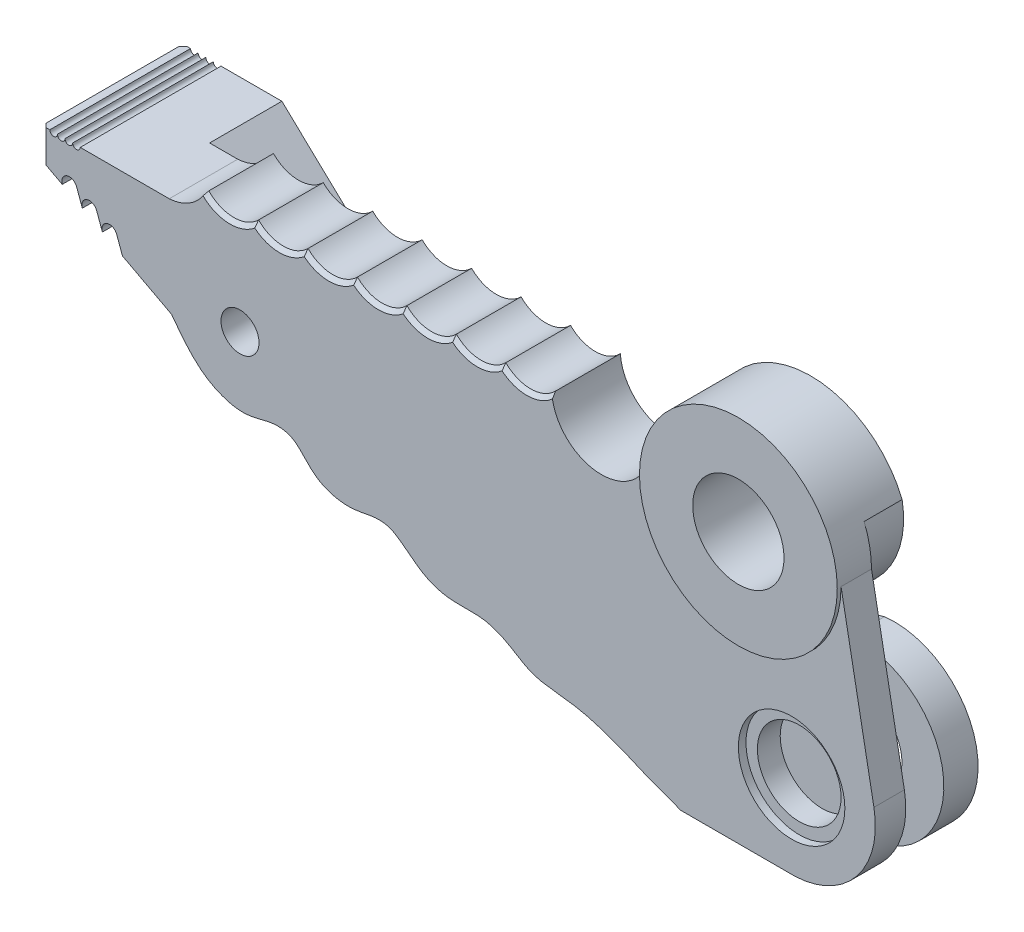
SolidWorks part; units mm, degrees
ref_plane "Plan de face" through (0, 0, 0) normal (0, 0, 1) x (1, 0, 0)
ref_plane "Plan de dessus" through (0, 0, 0) normal (0, 1, 0) x (1, 0, 0)
ref_plane "Plan de droite" through (0, 0, 0) normal (1, 0, 0) x (0, 0, -1)
sketch "Esquisse1" plane through (0, 0, 0) normal (0, 0, 1) x (1, 0, 0)
  line L0 (-184, 0) -> (-184, -8)
  line L1 (-40.104, -69) -> (-13.1461, -69) construction
  line L2 (-24, -58.5271) -> (-24, -76.972) construction
  line L3 (-184, -8) -> (-150, -26)
  line L4 (-24, -69) -> (-16.1311, -72)
  line L5 (-16.1311, -72) -> (13.8689, -72)
  line L6 (7.4271, -50) -> (26.1085, -50) construction
  line L7 (13, -42.2105) -> (13, -60.1824) construction
  line L8 (26, 0) -> (34.6378, -45.9307)
  line L9 (-184, 0) -> (-48, 0)
  line L10 (-48, 18.0902) -> (-48, -11.4689) construction
  line L11 (-46.6134, -6) -> (-28.0968, -6) construction
  line L12 (-150, -26) -> (-24, -69)
  circle A0 centre (0, 0) radius 12
  arc A1 (26, 0) -> (-26, 0) centre (0, 0) ccw
  circle A2 centre (13, -50) radius 11
  arc A3 (13.8689, -72) -> (34.6378, -45.9307) centre (13, -50) ccw
  arc A4 (-26, 0) -> (-48, 0) centre (-37, 7.0833) cw
  dimension "D1" = 24
  dimension "D3" = 52
  dimension "D11" = 22
  dimension "D2" = 184
  dimension "D4" = 69
  dimension "D5" = 24
  dimension "D6" = 8
  dimension "D7" = 72
  dimension "D8" = 30
  dimension "D9" = 50
  dimension "D10" = 13
  dimension "D12" = 22
  dimension "D13" = 6
  dimension "D14" = 34
  dimension "D15" = 26
extrude "Boss.-Extru.1" add sketch "Esquisse1" along normal blind 18 and the other way blind 19
sketch "Esquisse2" plane through (0, 0, 18) normal (0, 0, 1) x (1, 0, 0)
  line L0 (-132, 21.1529) -> (-132, -42.2526) construction
  line L1 (-140.7591, -21) -> (-123.9133, -21) construction
  line L2 (-48, 0) -> (-184, 0) construction
  circle A0 centre (-132, -21) radius 5
  dimension "D3" = 10
  dimension "D1" = 132
  dimension "D2" = 21
extrude "Enlèv. mat.-Extru.1" cut sketch "Esquisse2" against normal through all
sketch "Esquisse3" plane through (0, 0, 18) normal (0, 0, 1) x (1, 0, 0)
  line L0 (-177.3988, -14.4414) -> (-178.7273, -10.7914)
  line L1 (-48, 0) -> (-184, 0) construction
  line L2 (-184, -8) -> (-150, -26) construction
  line L4 (-173.4546, -13.5829) -> (-174.9685, -9.4234)
  line L6 (-162.0168, -21.6174) -> (-164.4231, -15.0062)
  line L7 (-177.3988, -14.4414) -> (-162.0168, -21.6174)
  line L8 (-168.1819, -16.3743) -> (-169.6958, -12.2148)
  arc A0 (-178.7273, -10.7914) -> (-174.9685, -9.4234) centre (-176.8479, -10.1074) cw
  arc A1 (-173.4546, -13.5829) -> (-169.6958, -12.2148) centre (-171.5752, -12.8988) cw
  arc A2 (-168.1819, -16.3743) -> (-164.4231, -15.0062) centre (-166.3025, -15.6903) cw
  dimension "D1" = 70
  dimension "D3" = 4
  dimension "D4" = 4
extrude "Enlèv. mat.-Extru.2" cut sketch "Esquisse3" against normal through all
sketch "Esquisse5" plane through (0, 0, 18) normal (0, 0, 1) x (1, 0, 0)
  line L0 (-48, 0) -> (-184, 0) construction
  circle A0 centre (-181, 0) radius 1
  dimension "D2" = 2
  dimension "D1" = 3
extrude "Enlèv. mat.-Extru.3" cut sketch "Esquisse5" against normal through all
pattern_linear "Répétition linéaire1" count 4 spacing 2 along (1, 0, 0) of "Enlèv. mat.-Extru.3"
chamfer "Chanfrein1" distance 1 angle 45 2 edges at (-184, -4, -19) (-184, -4, 18)
sketch "Esquisse7" plane through (0, 0, -19) normal (0, 0, -1) x (-1, 0, 0)
  line L0 (184, -8) -> (184, 0) construction
  line L1 (-77.3107, 50.9095) -> (158, 50.9095)
  line L2 (-77.3107, 50.9095) -> (-77.3107, -80.261)
  line L3 (-77.3107, -80.261) -> (158, -80.261)
  line L4 (158, 50.9095) -> (158, 0)
  line L5 (158, 0) -> (140, -17)
  line L6 (48, 0) -> (174, 0) construction
  line L7 (140, -17) -> (158, -80.261)
  line L8 (184, 0) -> (184, -8) construction
  point P4 (184, -4)
  dimension "D1" = 26
  dimension "D2" = 44
  dimension "D3" = 17
extrude "Enlèv. mat.-Extru.4" cut sketch "Esquisse7" against normal blind 10
fillet "Congé1" radius 2 1 edges at (-143.2193, -28.3141, -14)
sketch "Esquisse10" plane through (0, 0, 0) normal (0, 0, 1) x (1, 0, 0)
  line L0 (34.6378, -45.9307) -> (26, 0) construction
  line L1 (-16.1311, -72) -> (13.8689, -72) construction
  line L2 (-24, -69) -> (-16.1311, -72) construction
  line L3 (34.6378, -45.9307) -> (26, 0)
  line L4 (-16.1311, -72) -> (13.8689, -72)
  line L5 (-24, -69) -> (-16.1311, -72)
  arc A0 (-24, -69) -> (12.8789, -14.8236) centre (103.2767, -115.9994) cw
  arc A1 (12.8789, -14.8236) -> (24.0597, 9.8555) centre (0.6087, 5.6076) ccw
  arc A2 (26, 0) -> (-26, 0) centre (0, 0) ccw construction
  arc A3 (13.8689, -72) -> (34.6378, -45.9307) centre (13, -50) ccw construction
  arc A4 (26, 0) -> (24.0597, 9.8555) centre (0, 0) ccw
  arc A5 (13.8689, -72) -> (34.6378, -45.9307) centre (13, -50) ccw
extrude "Enlèv. mat.-Extru.6" cut sketch "Esquisse10" along normal blind 10
sketch "Esquisse11" plane through (0, 0, -9) normal (0, 0, -1) x (-1, 0, 0)
  line L0 (16.1311, -72) -> (-13.8689, -72) construction
  line L2 (25.4444, -13) -> (131.0723, -13)
  line L3 (48, 0) -> (158, 0) construction
  line L4 (142.6429, -26.2884) -> (140, -17) construction
  line L6 (145.2125, -27.6338) -> (24, -69) construction
  line L7 (142.6429, -26.2884) -> (141.0592, -20.7225)
  line L9 (145.2125, -27.6338) -> (31.3866, -66.4792)
  line L10 (24, 0) -> (32, -72) construction
  line L11 (25.4444, -13) -> (31.3866, -66.4792)
  arc A0 (142.6429, -26.2884) -> (145.2125, -27.6338) centre (144.5665, -25.741) ccw construction
  arc A1 (142.6429, -26.2884) -> (145.2125, -27.6338) centre (144.5665, -25.741) ccw
  arc A2 (131.0723, -13) -> (141.0592, -20.7225) centre (129.6613, -25.1436) cw
  dimension "D1" = 24
  dimension "D2" = 32
  dimension "D3" = 13
extrude "Enlèv. mat.-Extru.7" cut sketch "Esquisse11" against normal blind 10
fillet "Congé4" radius 2 2 edges at (-25.4444, -13, -4) (-31.3866, -66.4792, -4)
sketch "Esquisse12" plane through (0, 0, -9) normal (0, 0, -1) x (-1, 0, 0)
  line L3 (142.6429, -26.2884) -> (140, -17) construction
  line L4 (140, -17) -> (158, 0) construction
  line L5 (48, 0) -> (158, 0) construction
  line L6 (141.0592, -20.7225) -> (140, -17)
  line L7 (140, -17) -> (158, 0)
  line L8 (48, 0) -> (158, 0)
  line L9 (131.0723, -13) -> (27.679, -13) construction
  line L10 (131.0723, -13) -> (27.679, -13)
  line L11 (22.5649, 12.9161) -> (25.6912, -15.2209)
  arc A0 (26, 0) -> (48, 0) centre (37, 7.0833) ccw construction
  arc A1 (26, 0) -> (-26, 0) centre (0, 0) ccw construction
  arc A2 (26, 0) -> (48, 0) centre (37, 7.0833) ccw
  arc A3 (26, 0) -> (22.5649, 12.9161) centre (0, 0) ccw
  arc A4 (141.0592, -20.7225) -> (131.0723, -13) centre (129.6613, -25.1436) ccw construction
  arc A5 (27.679, -13) -> (25.6912, -15.2209) centre (27.679, -15) ccw construction
  arc A6 (141.0592, -20.7225) -> (131.0723, -13) centre (129.6613, -25.1436) ccw
  arc A7 (27.679, -13) -> (25.6912, -15.2209) centre (27.679, -15) ccw
extrude "Enlèv. mat.-Extru.8" cut sketch "Esquisse12" against normal blind 9
sketch "Esquisse13" plane through (0, 0, 0) normal (0, 0, 1) x (1, 0, 0)
  line L0 (-63.2, 16.0994) -> (-63.2, -16.6098) construction
  line L2 (-70.0062, 6) -> (-47.7736, 6) construction
  line L3 (-48, 0) -> (-174, 0) construction
  line L4 (-48, 0) -> (-150.6007, 0)
  arc A0 (-48, 0) -> (-26, 0) centre (-37, 7.0833) ccw construction
  arc A1 (-50.0384, 6) -> (-48, 0) centre (-37, 7.0833) ccw
  arc A2 (-63.1192, 5.9177) -> (-50.0384, 6) centre (-56.6192, 12.3792) ccw
  arc A3 (-76.1192, 5.9177) -> (-63.1192, 5.9177) centre (-69.6192, 12.3792) ccw
  arc A4 (-89.1192, 5.9177) -> (-76.1192, 5.9177) centre (-82.6192, 12.3792) ccw
  arc A5 (-102.1192, 5.9177) -> (-89.1192, 5.9177) centre (-95.6192, 12.3792) ccw
  arc A6 (-115.1192, 5.9177) -> (-102.1192, 5.9177) centre (-108.6192, 12.3792) ccw
  arc A7 (-128.1192, 5.9177) -> (-115.1192, 5.9177) centre (-121.6192, 12.3792) ccw
  arc A8 (-141.2, 6) -> (-128.1192, 5.9177) centre (-134.6192, 12.3792) ccw
  arc A9 (-141.2, 6) -> (-150.6007, 0) centre (-151.3003, 11.4606) cw
  arc A10 (-154.2, 6) -> (-141.0384, 6) centre (-147.6192, 12.3792) ccw
  dimension "D2" = 6
  dimension "D1" = 15.2
  dimension "D3" = 8
extrude "Boss.-Extru.2" add sketch "Esquisse13" along normal up to surface (18 mm away)
chamfer "Chanfrein2" distance 1 angle 45 7 edges at (-56.5615, 3.2142, 18) (-69.6192, 3.214, 18) (-82.6192, 3.214, 18) (-95.6192, 3.214, 18) (-108.6192, 3.214, 18) (-121.6192, 3.214, 18) (-134.6769, 3.2142, 18)
sketch "Esquisse14" plane through (0, 0, -9) normal (0, 0, -1) x (-1, 0, 0)
  line L0 (-34.6378, -45.9307) -> (-26, 0) construction
  line L1 (-34.6378, -45.9307) -> (-28.0171, -10.7257)
  arc A0 (-10.4109, -28.1356) -> (-34.6378, -45.9307) centre (-13, -50) ccw
  arc A1 (-10.4109, -28.1356) -> (-28.0171, -10.7257) centre (0, 0) ccw
  dimension "D1" = 60
extrude "Enlèv. mat.-Extru.9" cut sketch "Esquisse14" against normal up to surface (9 mm away)
fillet "Congé6" radius 2 1 edges at (-25.7165, -15.4486, -4.5)
sketch "Esquisse17" plane through (0, 0, 18) normal (0, 0, 1) x (1, 0, 0)
  circle A2 centre (0, 0) radius 26
  circle A3 centre (0, 0) radius 12 construction
  circle A4 centre (0, 0) radius 12
extrude "Boss.-Extru.5" add sketch "Esquisse17" along normal blind 1
sketch "Esquisse19" plane through (0, 0, 18) normal (0, 0, 1) x (1, 0, 0)
  circle A0 centre (13, -50) radius 14
  dimension "D1" = 28
extrude "Enlèv. mat.-Extru.11" cut sketch "Esquisse19" against normal blind 2
sketch "Esquisse20" plane through (0, 0, 18) normal (0, 0, 1) x (1, 0, 0)
  line L0 (-150, -26) -> (-24, -69) construction
  line L1 (-150, -26) -> (-44.0333, -62.1632)
  line L2 (-154.9672, -32.9317) -> (-53.8484, -60.7151) construction
  spline S0 degree 3 poles (-150, -26) (-145.4549, -32.3161) (-141.0937, -36.82) (-129.0726, -40.0365) (-124.8626, -36.7545) (-116.1133, -38.3797) (-113.6556, -44.3657) (-101.8434, -47.5208) (-97.4422, -44.7868) (-90.267, -46.3871) (-85.2228, -51.9179) (-75.5818, -55.0368) (-70.1109, -53.5089) (-61.1867, -56.4551) (-57.6043, -59.6402) (-51.5234, -61.407) (-47.7784, -61.5683) (-44.0333, -62.1632) knots 0 0 0 0 0.126658 0.155417 0.272905 0.29975 0.397016 0.421976 0.524395 0.546503 0.620942 0.641373 0.73038 0.751623 0.832562 0.850028 0.916163 0.916163 0.916163 0.916163
  dimension "D1" = 8
  dimension "D2" = 28
  dimension "D3" = 28
sketch "Esquisse21" plane through (0, 0, 0) normal (0, 0, 1) x (1, 0, 0)
  line L1 (-44.0333, -62.1632) -> (-25.26, -68.57)
  spline S1 degree 2 poles (-44.0333, -62.1632) (-36.912, -63.2946) (-25.26, -68.57) knots 0.916163 0.916163 0.916163 1 1 1
extrude "Boss.-Extru.6" add sketch "Esquisse20" against normal up to surface (17 mm away)
extrude "Enlèv. mat.-Extru.12" cut sketch "Esquisse21" along normal up to surface (18 mm away)
